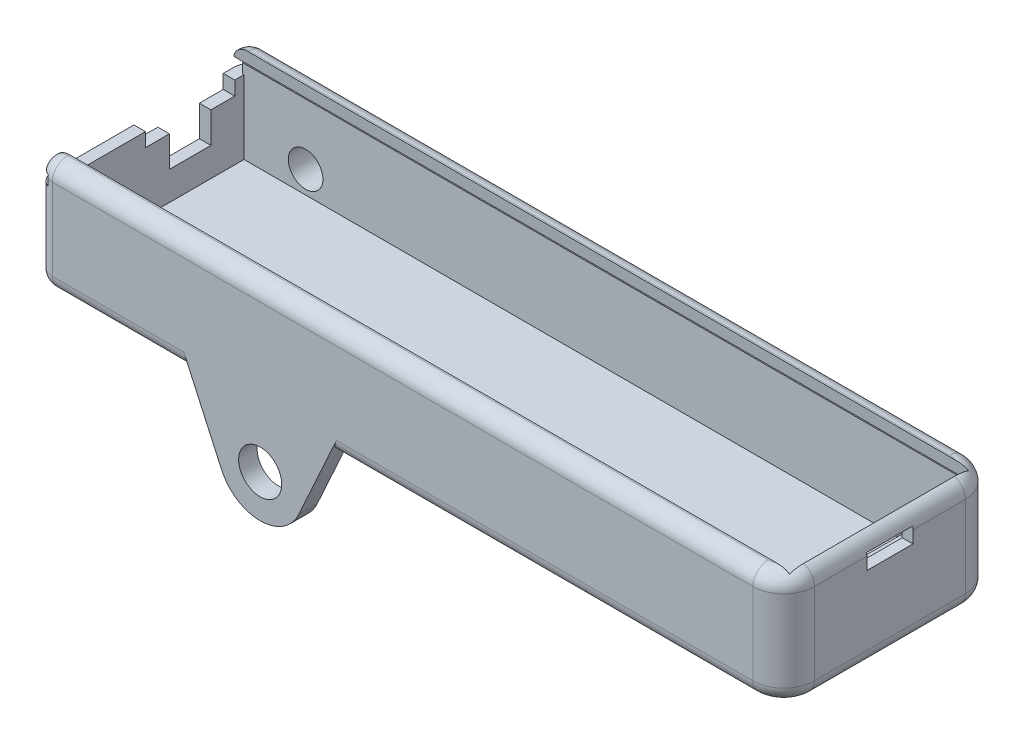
SolidWorks part; units mm, degrees
ref_plane "Front" through (0, 0, 0) normal (0, 0, 1) x (1, 0, 0)
ref_plane "Top" through (0, 0, 0) normal (0, 1, 0) x (1, 0, 0)
ref_plane "Right" through (0, 0, 0) normal (1, 0, 0) x (0, 0, -1)
sketch "Sketch1" plane through (0, 0, 0) normal (0, 1, 0) x (1, 0, 0)
  line L0 (0, 0) -> (123.19, 0)
  line L1 (0, 0) -> (0, 35.052)
  line L2 (123.19, 35.052) -> (0, 35.052)
  line L3 (123.19, 35.052) -> (123.19, 0)
  dimension "Length" = 123.19
  dimension "Width" = 35.052
extrude "Base-Extrude" add sketch "Sketch1" along normal blind 18.542
shell "Shell1" thickness 2.794
sketch "Sketch3" plane through (-30.8976, 18.1349, 0) normal (0, 0, 1) x (1, 0, 0)
  line L1 (30.8976, -18.1349) -> (154.0876, -18.1349) construction
  line L2 (56.2976, -18.1349) -> (79.1576, -18.1349)
  line L3 (30.8976, 0.4071) -> (30.8976, -18.1349) construction
  line L6 (61.3697, -29.2827) -> (56.2976, -18.1349)
  line L7 (74.0854, -29.2827) -> (79.1576, -18.1349)
  line L9 (67.7276, -26.3899) -> (67.7276, -18.7454) construction
  arc A0 (74.0854, -29.2827) -> (61.3697, -29.2827) centre (67.7276, -26.3899) cw
  circle A1 centre (67.7276, -26.3899) radius 3.556
  dimension "D6" = 6.985
  dimension "D3" = 7.112
  dimension "D2" = 25.4
  dimension "D4" = 22.86
  dimension "D1" = 15.24
extrude "Tab" add sketch "Sketch3" against normal blind 3.048
fillet "Fillet1" radius 5.08
fillet "Fillet2" radius 2.54
sketch "Sketch16" plane through (0, 0, -3.048) normal (0, 0, -1) x (-1, 0, 0)
  point P0 (-36.83, -8.255)
sketch "Sketch17" plane through (0, 0, 0) normal (0, 0, 1) x (1, 0, 0)
  point P0 (36.83, -8.255)
ref_plane "Plane1" through (36.83, 0, 0) normal (-1, 0, 0) x (0, 0, 1)
sketch "Sketch18" plane through (36.83, 0, 0) normal (-1, 0, 0) x (0, 0, 1)
  line L0 (-3.048, -15.24) -> (-3.048, -11.811) construction
  line L3 (-3.048, -11.811) -> (-1.524, -11.811) construction
  line L4 (-1.524, -11.811) -> (-1.524, -15.24) construction
  line L5 (-3.048, -11.811) -> (-3.048, -12.065)
  line L6 (0, -8.255) -> (-3.048, -8.255) construction
  line L7 (-3.048, -12.065) -> (-1.524, -14.986)
  line L8 (-1.524, -14.986) -> (-1.524, -15.24)
  dimension "D1" = 1.524
  dimension "D2" = 0.254
  dimension "D3" = 0.254
surface "Surface1" sketch "Sketch18" parameters "D1"=360
sketch "Sketch4" plane through (0, 0, -3.048) normal (0, 0, -1) x (-1, 0, 0)
  line L0 (-33.274, -8.255) -> (-33.274, -14.2671) construction
  line L1 (-40.386, -8.255) -> (-40.386, -14.2671) construction
  line L2 (-40.132, -14.4102) -> (-40.132, -9.5748)
  line L3 (-33.528, -14.4102) -> (-33.528, -9.5748)
  circle A0 centre (-36.83, -8.255) radius 3.556 construction
  arc A1 (-43.1878, -11.1478) -> (-30.4722, -11.1478) centre (-36.83, -8.255) ccw construction
  arc A2 (-40.132, -9.5748) -> (-33.528, -9.5748) centre (-36.83, -8.255) ccw
  arc A3 (-40.132, -14.4102) -> (-33.528, -14.4102) centre (-36.83, -8.255) ccw
  dimension "D1" = 0.254
  dimension "D2" = 0.254
extrude "Snap bevel" cut sketch "Sketch4" against normal up to surface (1.524 mm away)
ref_plane "Mirror Plane" through (0, 0, -17.526) normal (0, 0, -1) x (-1, 0, 0)
mirror "Mirror8" about plane through (0, 0, -17.526) normal (0, 0, -1)
mirror "Mirror9" about plane through (0, 0, -17.526) normal (0, 0, -1)
fillet "Fillet4" radius 2.54
fillet "Fillet6" radius 2.54
sketch "Sketch19" plane through (0.6366, 0, 0.629) normal (0, -1, 0) x (1, 0, 0)
  line L2 (-38.7052, -18.155) -> (37.432, -18.155) construction
  line L3 (-0.6366, -3.169) -> (-0.6366, -33.141) construction
  circle A0 centre (13.9684, -18.155) radius 9.271
  circle A1 centre (13.9684, -18.155) radius 8.001
  dimension "D1" = 18.542
  dimension "D2" = 16.002
  dimension "D4" = 14.605
extrude "Spring retainer" add sketch "Sketch19" along normal blind 1.778
fillet "Fillet8" radius 2.54
sketch "Sketch20" plane through (1.905, 0, 0) normal (1, 0, 0) x (0, 0, -1)
  line L0 (26.797, 12.6193) -> (30.734, 12.6193)
  line L2 (2.794, 14.9053) -> (16.002, 14.9053)
  line L3 (26.797, 12.6193) -> (26.797, 7.5393)
  line L4 (2.794, 18.4613) -> (2.794, 2.794)
  line L5 (2.794, 2.794) -> (32.258, 2.794)
  line L6 (32.258, 2.794) -> (32.258, 18.4613)
  line L7 (32.258, 18.4613) -> (2.794, 18.4613)
  line L8 (2.794, 18.4613) -> (2.794, 14.9053)
  line L9 (19.939, 7.5393) -> (26.797, 7.5393)
  line L10 (32.258, 14.9053) -> (32.258, 18.4613)
  line L11 (32.258, 18.4613) -> (2.794, 18.4613)
  line L12 (19.939, 7.5393) -> (19.939, 12.6193)
  line L13 (30.734, 14.9053) -> (32.258, 14.9053)
  line L14 (30.734, 14.9053) -> (30.734, 12.6193)
  line L15 (16.002, 12.6193) -> (19.939, 12.6193)
  line L16 (16.002, 12.6193) -> (16.002, 14.9053)
  dimension "D3" = 6.858
  dimension "D4" = 14.732
  dimension "D5" = 5.08
  dimension "D2" = 3.556
  dimension "D6" = 13.208
  dimension "D7" = 1.524
  dimension "D8" = 2.286
  dimension "D1" = 0
extrude "Switch cut-out" cut sketch "Sketch20" against normal through all
sketch "Sketch21" plane through (0, 0, 0) normal (-1, 0, 0) x (0, 0, 1)
  line L0 (-35.052, 16.51) -> (0, 16.51)
  line L1 (-35.052, 16.51) -> (-35.052, 14.9053)
  line L2 (0, 14.9053) -> (-35.052, 14.9053)
  line L3 (0, 14.9053) -> (0, 16.51)
  line L4 (-2.794, 14.9053) -> (-16.002, 14.9053) construction
  line L5 (0, 16.002) -> (0, 2.54) construction
  line L6 (-35.052, 2.54) -> (-35.052, 16.002) construction
  line L7 (-31.0792, 18.542) -> (-3.9728, 18.542) construction
  dimension "D1" = 1.6047
  dimension "D2" = 2.032
extrude "Cut-Extrude3" cut sketch "Sketch21" against normal blind 1.651
sketch "Sketch22" plane through (0, 0, 0) normal (-1, 0, 0) x (0, 0, 1)
  line L0 (-30.734, 12.6193) -> (-16.002, 12.6193)
  line L1 (-30.734, 12.6193) -> (-30.734, 3.7293)
  line L2 (-16.002, 3.7293) -> (-30.734, 3.7293)
  line L3 (-16.002, 3.7293) -> (-16.002, 12.6193)
  line L4 (-16.002, 12.6193) -> (-16.002, 14.9053) construction
  dimension "D1" = 8.89
extrude "On-Off recess" cut sketch "Sketch22" against normal blind 1.016
sketch "Sketch23" plane through (0, 0, -35.052) normal (0, 0, -1) x (-1, 0, 0)
  line L0 (0, 14.9053) -> (0, 2.54) construction
  line L1 (-118.11, 18.542) -> (-2.54, 18.542) construction
  circle A1 centre (-12.065, 6.477) radius 2.8575
  dimension "D2" = 5.715
  dimension "D3" = 12.065
  dimension "D4" = 12.065
extrude "Wire hole" cut sketch "Sketch23" against normal up to next
sketch "Sketch25" plane through (0, 2.794, 0) normal (0, 1, 0) x (-1, 0, 0)
  line L0 (-13.843, -32.258) -> (-13.843, -4.572)
  line L1 (-119.2172, -32.258) -> (-2.54, -32.258) construction
  line L2 (-1.905, -2.794) -> (-1.905, -16.002) construction
  dimension "D1" = 11.938
  dimension "D2" = 27.686
extrude "Battery divider" add sketch "Sketch25" along normal blind 12.7 thin
sketch "Sketch26" plane through (0, 0, -35.052) normal (0, 0, -1) x (-1, 0, 0)
  circle A0 centre (-12.065, 6.477) radius 2.8575 construction
  circle A1 centre (-12.065, 6.477) radius 4.1275
  circle A2 centre (-12.065, 6.477) radius 4.1275
  circle A3 centre (-12.065, 6.477) radius 2.8575
  dimension "D1" = 1.27
extrude "Arm pivot" add sketch "Sketch26" along normal blind 4.318
sketch "Sketch27" plane through (0, 0, -39.37) normal (0, 0, -1) x (-1, 0, 0)
  circle A0 centre (-12.065, 6.477) radius 2.8575 construction
  circle A1 centre (-12.065, 6.477) radius 5.3975
  circle A2 centre (-12.065, 6.477) radius 5.3975
  circle A3 centre (-12.065, 6.477) radius 2.8575
  dimension "D1" = 1.27
extrude "Arm snap collar" add sketch "Sketch27" along normal blind 1.778
chamfer "Chamfer2" distance 1.27 angle 45
sketch "Sketch28" plane through (0, 0, -41.148) normal (0, 0, -1) x (-1, 0, 0)
  line L0 (-17.425, 7.112) -> (-6.705, 7.112)
  line L2 (-6.705, 5.842) -> (-17.425, 5.842)
  circle A0 centre (-12.065, 6.477) radius 5.3975 construction
  arc A1 (-17.425, 7.112) -> (-17.425, 5.842) centre (-12.065, 6.477) ccw
  arc A2 (-6.705, 5.842) -> (-6.705, 7.112) centre (-12.065, 6.477) ccw
  dimension "D1" = 1.27
extrude "Snap collar relief" cut sketch "Sketch28" against normal offset from surface (4.826 mm away) 1.27
sketch "Sketch29" plane through (0, 0, -35.052) normal (0, 0, -1) x (-1, 0, 0)
  line L0 (-21.4312, 2.54) -> (-2.6988, 2.54)
  line L1 (-24.2443, 2.54) -> (-13.3045, 2.54) construction
  arc A0 (-21.4312, 2.54) -> (-2.6988, 2.54) centre (-12.065, 6.477) ccw
  dimension "D1" = 20.32
extrude "Arm backing plate" add sketch "Sketch29" against normal blind 2.032
sketch "Sketch30" plane through (0, 18.542, 0) normal (0, 1, 0) x (-1, 0, 0)
  line L0 (-120.396, -32.258) -> (-121.412, -32.258)
  line L1 (-120.396, -32.258) -> (-120.396, -2.794)
  line L2 (-121.412, -2.794) -> (-120.396, -2.794)
  line L3 (-121.412, -2.794) -> (-121.412, -32.258)
  line L4 (-2.54, -2.794) -> (-119.2172, -2.794) construction
  line L5 (-123.19, -29.972) -> (-123.19, -5.08) construction
  line L7 (-120.396, -32.258) -> (-120.396, -2.794) construction
  line L8 (-119.2172, -32.258) -> (-2.54, -32.258) construction
  dimension "D1" = 1.778
  dimension "D2" = 1.016
extrude "Cut-Extrude4" cut sketch "Sketch30" against normal blind 5.08
sketch "Sketch31" plane through (121.412, 0, 0) normal (-1, 0, 0) x (0, 0, 1)
  line L0 (-21.336, 13.97) -> (-13.716, 13.97)
  line L1 (-21.336, 13.97) -> (-21.336, 16.51)
  line L2 (-13.716, 16.51) -> (-21.336, 16.51)
  line L3 (-13.716, 16.51) -> (-13.716, 13.97)
  line L7 (-2.794, 18.542) -> (-32.258, 18.542) construction
  line L8 (-2.794, 13.462) -> (-32.258, 13.462) construction
  point P6 (-17.526, 16.51)
  point P8 (-17.526, 13.462)
  dimension "D1" = 2.54
  dimension "D2" = 7.62
  dimension "D3" = 2.032
extrude "Cut-Extrude5" cut sketch "Sketch31" against normal through all
sketch "Sketch33" plane through (0, 0, 0) normal (-1, 0, 0) x (0, 0, 1)
  line L0 (-2.794, 18.542) -> (-2.794, 16.51) construction
  line L1 (-2.794, 18.542) -> (-2.794, 16.51)
  line L2 (-2.794, 16.51) -> (-2.6162, 16.51)
  line L3 (-2.6162, 16.51) -> (-2.794, 18.542)
  dimension "D1" = 2.032
  dimension "D2" = 5
extrude "Cover groove1" cut sketch "Sketch33" against normal up to surface (121.412 mm away)
mirror "Mirror10" about plane through (0, 0, -17.526) normal (0, 0, -1)
sketch "Sketch35" plane through (37.0512, 2.794, -25.1154) normal (0, 1, 0) x (-1, 0, 0)
  line L0 (-23.7818, 2.1284) -> (-25.1788, 2.1284)
  line L1 (-23.7818, 2.1284) -> (-23.7818, 1.6204)
  line L2 (-27.0838, 1.6204) -> (-25.6868, 1.6204)
  line L3 (-27.0838, 1.6204) -> (-27.0838, 2.1284)
  line L4 (-25.1788, 0.2234) -> (-25.6868, 0.2234)
  line L5 (-25.1788, 0.2234) -> (-25.1788, 1.6204)
  line L6 (-25.6868, 3.5254) -> (-25.1788, 3.5254)
  line L7 (-25.6868, 3.5254) -> (-25.6868, 2.1284)
  line L8 (-25.1788, 1.6204) -> (-23.7818, 1.6204)
  line L9 (-25.1788, 2.1284) -> (-25.1788, 3.5254)
  line L10 (-25.6868, 2.1284) -> (-27.0838, 2.1284)
  line L11 (-25.6868, 1.6204) -> (-25.6868, 0.2234)
  line L12 (-82.166, -7.1426) -> (34.5112, -7.1426) construction
  line L13 (11.7782, 2.1284) -> (8.4762, 2.1284)
  line L14 (11.7782, 2.1284) -> (11.7782, 1.6204)
  line L15 (8.4762, 1.6204) -> (11.7782, 1.6204)
  line L16 (8.4762, 1.6204) -> (8.4762, 2.1284)
  line L17 (21.9382, -7.1426) -> (21.9382, 20.5434) construction
  line L18 (7.2062, -2.0626) -> (-21.2418, -2.0626)
  line L19 (7.2062, -2.0626) -> (7.2062, 5.8114)
  line L20 (-21.2418, 5.8114) -> (7.2062, 5.8114)
  line L21 (-21.2418, 5.8114) -> (-21.2418, 3.5254)
  line L22 (-21.2418, 3.5254) -> (-22.5118, 3.5254)
  line L23 (-21.2418, 0.2234) -> (-21.2418, -2.0626)
  line L24 (-22.5118, 0.2234) -> (-21.2418, 0.2234)
  line L25 (-22.5118, 0.2234) -> (-22.5118, 3.5254)
  line L26 (6.6982, 5.3034) -> (-20.7338, 5.3034)
  line L27 (6.6982, 5.3034) -> (6.6982, -1.5546)
  line L28 (-20.7338, -1.5546) -> (6.6982, -1.5546)
  line L29 (-20.7338, -1.5546) -> (-20.7338, 0.7314)
  line L30 (-20.7338, 0.7314) -> (-22.0038, 0.7314)
  line L31 (-20.7338, 3.0174) -> (-20.7338, 5.3034)
  line L32 (-22.0038, 3.0174) -> (-20.7338, 3.0174)
  line L33 (-22.0038, 3.0174) -> (-22.0038, 0.7314)
  dimension "D1" = 7.874
  dimension "thickness" = 0.508
  dimension "D2" = 1.27
  dimension "D3" = 28.448
  dimension "D4" = 1.27
  dimension "D5" = 1.27
  dimension "D6" = 3.302
  dimension "D7" = 3.302
  dimension "D8" = 5.08
  dimension "D9" = 14.732
extrude "Boss-Extrude2" add sketch "Sketch35" along normal blind 0.381
sketch "Sketch36" plane through (46.1641, 2.794, -11.731) normal (0, -1, 0) x (1, 0, 0)
  line L0 (-17.5891, 0.174) -> (-18.9861, 0.174)
  line L1 (-17.5891, 0.174) -> (-17.5891, -0.334)
  line L2 (-20.8911, -0.334) -> (-19.4941, -0.334)
  line L3 (-20.8911, -0.334) -> (-20.8911, 0.174)
  line L4 (-18.9861, -1.731) -> (-19.4941, -1.731)
  line L5 (-18.9861, -1.731) -> (-18.9861, -0.334)
  line L6 (-19.4941, 1.571) -> (-18.9861, 1.571)
  line L7 (-19.4941, 1.571) -> (-19.4941, 0.174)
  line L8 (-18.9861, -0.334) -> (-17.5891, -0.334)
  line L9 (-18.9861, 0.174) -> (-18.9861, 1.571)
  line L10 (-19.4941, 0.174) -> (-20.8911, 0.174)
  line L11 (-19.4941, -0.334) -> (-19.4941, -1.731)
  line L12 (-16.3191, -15.447) -> (-16.3191, -7.573) construction
  line L13 (17.9709, 0.174) -> (14.6689, 0.174)
  line L14 (17.9709, 0.174) -> (17.9709, -0.334)
  line L15 (14.6689, -0.334) -> (17.9709, -0.334)
  line L16 (14.6689, -0.334) -> (14.6689, 0.174)
  line L17 (-43.6241, 8.937) -> (73.0531, 8.937) construction
  line L18 (13.3989, -4.017) -> (-15.0491, -4.017)
  line L19 (13.3989, -4.017) -> (13.3989, 3.857)
  line L20 (-15.0491, 3.857) -> (13.3989, 3.857)
  line L21 (-15.0491, 3.857) -> (-15.0491, 1.571)
  line L22 (-15.0491, 1.571) -> (-16.3191, 1.571)
  line L23 (-15.0491, -1.731) -> (-15.0491, -4.017)
  line L24 (-16.3191, -1.731) -> (-15.0491, -1.731)
  line L25 (-16.3191, -1.731) -> (-16.3191, 1.571)
  line L26 (12.8909, 3.349) -> (-14.5411, 3.349)
  line L27 (12.8909, 3.349) -> (12.8909, -3.509)
  line L28 (-14.5411, -3.509) -> (12.8909, -3.509)
  line L29 (-14.5411, -3.509) -> (-14.5411, -1.223)
  line L30 (-14.5411, -1.223) -> (-15.8111, -1.223)
  line L31 (-14.5411, 1.063) -> (-14.5411, 3.349)
  line L32 (-15.8111, 1.063) -> (-14.5411, 1.063)
  line L33 (-15.8111, 1.063) -> (-15.8111, -1.223)
  dimension "D1" = 7.874
  dimension "thickness" = 0.508
  dimension "D2" = 1.27
  dimension "D3" = 28.448
  dimension "D4" = 1.27
  dimension "D5" = 1.27
  dimension "D6" = 3.302
  dimension "D7" = 3.302
  dimension "D8" = 5.08
extrude "Boss-Extrude3" add sketch "Sketch36" against normal blind 0.381
pattern_linear "LPattern1" count 2 spacing 45.212
